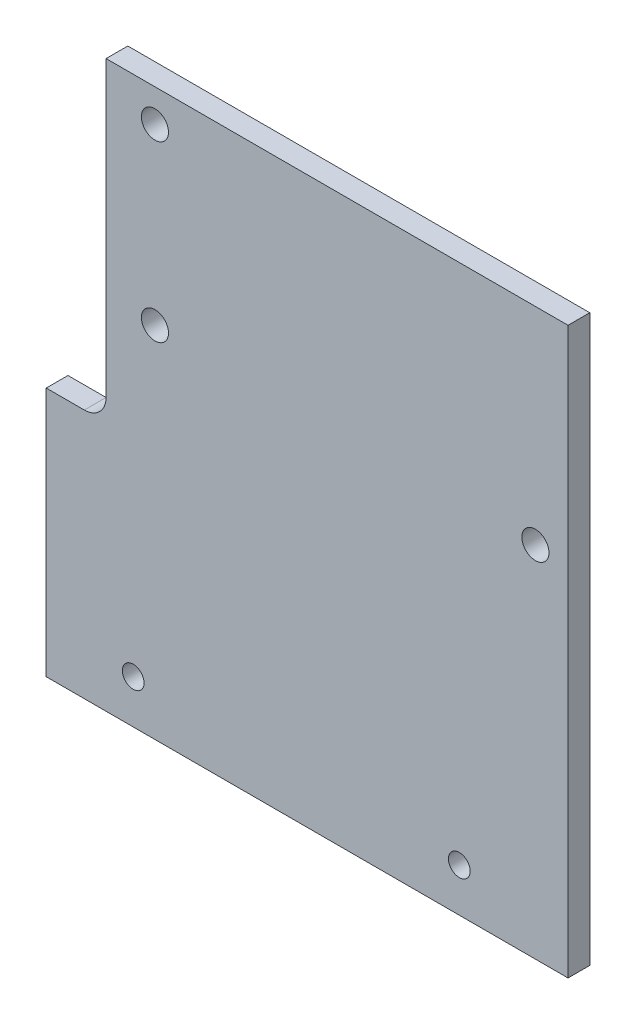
SolidWorks part; units mm, degrees
ref_plane "Front Plane" through (0, 0, 0) normal (0, 0, 1) x (1, 0, 0)
ref_plane "Top Plane" through (0, 0, 0) normal (0, 1, 0) x (1, 0, 0)
ref_plane "Right Plane" through (0, 0, 0) normal (1, 0, 0) x (0, 0, -1)
sketch "Sketch1" plane through (0, 0, 0) normal (0, 0, 1) x (1, 0, 0)
  line L0 (0, 0) -> (152.4, 0)
  line L1 (152.4, 0) -> (152.4, 165.1)
  line L2 (152.4, 165.1) -> (0, 165.1)
  line L3 (0, 165.1) -> (0, 0)
  circle A0 centre (142.875, 104.775) radius 3.9624
  circle A1 centre (31.75, 104.775) radius 3.9624
  circle A2 centre (31.75, 155.575) radius 3.9624
  circle A3 centre (120.65, 12.7) radius 3.175
  circle A4 centre (25.4, 12.7) radius 3.175
  dimension "D4" = 7.9248
  dimension "D8" = 6.35
  dimension "D1" = 152.4
  dimension "D2" = 165.1
  dimension "D3" = 111.125
  dimension "D5" = 9.525
  dimension "D6" = 9.525
  dimension "D7" = 50.8
  dimension "D9" = 25.4
  dimension "D10" = 95.25
  dimension "D11" = 12.7
sketch "Sketch2" plane through (0, 0, 0) normal (0, 0, 1) x (1, 0, 0)
  line L0 (152.4, 165.1) -> (0, 165.1) construction
  line L1 (0, 165.1) -> (0, 0) construction
  line L2 (0, 0) -> (152.4, 0) construction
  line L3 (152.4, 0) -> (152.4, 165.1) construction
  line L4 (152.4, 165.1) -> (17.4752, 165.1)
  line L5 (0, 73.025) -> (0, 0)
  line L6 (0, 0) -> (152.4, 0)
  line L7 (152.4, 0) -> (152.4, 165.1)
  line L8 (17.4752, 165.1) -> (17.4752, 73.025)
  line L9 (17.4752, 73.025) -> (0, 73.025)
  circle A0 centre (31.75, 155.575) radius 3.9624 construction
  circle A1 centre (31.75, 104.775) radius 3.9624 construction
  circle A2 centre (142.875, 104.775) radius 3.9624 construction
  circle A3 centre (31.75, 155.575) radius 3.9624
  circle A4 centre (31.75, 104.775) radius 3.9624
  circle A5 centre (142.875, 104.775) radius 3.9624
  circle A6 centre (25.4, 12.7) radius 3.175 construction
  circle A7 centre (120.65, 12.7) radius 3.175 construction
  circle A8 centre (25.4, 12.7) radius 3.175
  circle A9 centre (120.65, 12.7) radius 3.175
  dimension "D1" = 17.4752
  dimension "D2" = 92.075
extrude "Boss-Extrude1" add sketch "Sketch2" along normal blind 6.35
fillet "Fillet1" radius 6.35 1 edges at (17.4752, 73.025, 3.175)
